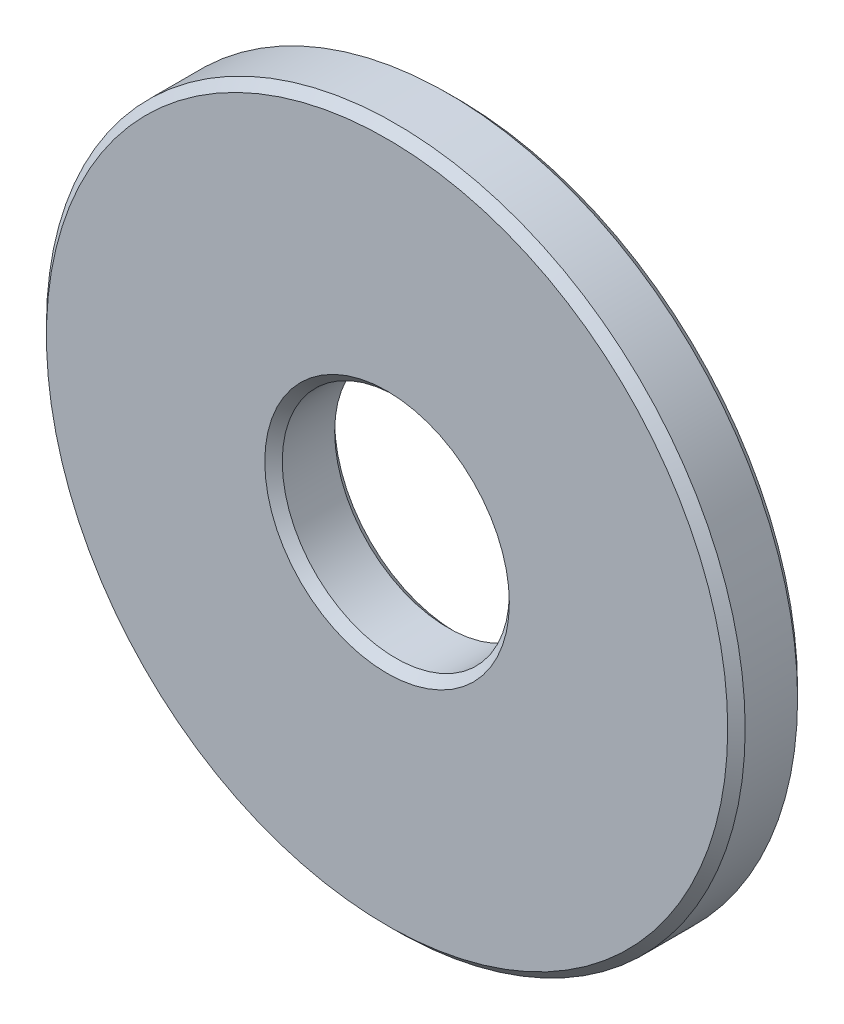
SolidWorks part; units mm, degrees
ref_plane "XY" through (0, 0, 0) normal (0, 0, 1) x (1, 0, 0)
ref_plane "XZ" through (0, 0, 0) normal (0, 1, 0) x (1, 0, 0)
ref_plane "YZ" through (0, 0, 0) normal (1, 0, 0) x (0, 0, -1)
sketch "Esquisse1" plane through (0, 0, 0) normal (0, 0, 1) x (1, 0, 0)
  circle A0 centre (0, 0) radius 3.25
  circle A1 centre (0, 0) radius 10
  dimension "D1" = 20
  dimension "D2" = 6.5
extrude "Rondelle" add sketch "Esquisse1" against normal blind 2
chamfer "Chanf 0.25" distance 0.25 angle 45
